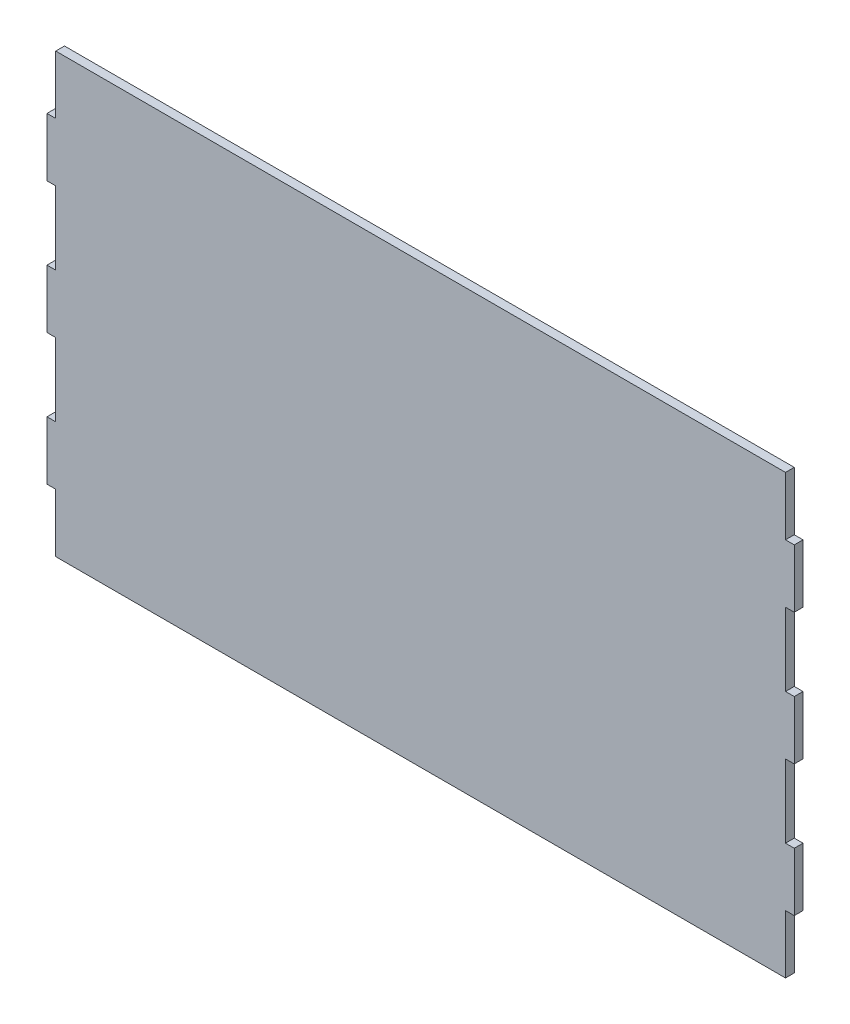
SolidWorks part; units mm, degrees
ref_plane "Alzado" through (0, 0, 0) normal (0, 0, 1) x (1, 0, 0)
ref_plane "Planta" through (0, 0, 0) normal (0, 1, 0) x (1, 0, 0)
ref_plane "Vista lateral" through (0, 0, 0) normal (1, 0, 0) x (0, 0, -1)
sketch "Croquis1" plane through (0, 0, 0) normal (0, 0, 1) x (1, 0, 0)
  line L0 (-500, 140) -> (-512, 140)
  line L1 (500, -380) -> (-500, -380)
  line L2 (500, -380) -> (500, -300)
  line L3 (500, 220) -> (-500, 220)
  line L4 (-500, -380) -> (-500, -300)
  line L5 (0, 220) -> (0, -380) construction
  line L7 (-512, 140) -> (-512, 60)
  line L8 (-512, 60) -> (-500, 60)
  line L9 (-500, -40) -> (-512, -40)
  line L10 (-512, -40) -> (-512, -120)
  line L11 (-512, -120) -> (-500, -120)
  line L12 (-500, -220) -> (-512, -220)
  line L13 (-512, -220) -> (-512, -300)
  line L14 (-512, -300) -> (-500, -300)
  line L15 (-500, 140) -> (-500, 220)
  line L16 (-500, -40) -> (-500, 60)
  line L17 (-500, -220) -> (-500, -120)
  line L18 (500, 140) -> (512, 140)
  line L19 (512, 140) -> (512, 60)
  line L20 (512, 60) -> (500, 60)
  line L21 (500, -40) -> (512, -40)
  line L22 (512, -40) -> (512, -120)
  line L23 (512, -120) -> (500, -120)
  line L24 (500, -220) -> (512, -220)
  line L25 (512, -220) -> (512, -300)
  line L26 (512, -300) -> (500, -300)
  line L27 (500, 140) -> (500, 220)
  line L28 (500, -40) -> (500, 60)
  line L29 (500, -220) -> (500, -120)
  point P0 (0, 0)
extrude "Saliente-Extruir1" add sketch "Croquis1" along normal blind 12
equation "\"Material\"= 12"
equation "\"D3@Croquis1\"=\"Material\""
equation "\"D4@Croquis1\"=\"Material\""
equation "\"D5@Croquis1\"=\"Material\""
equation "\"DsPared\" = 80"
equation "\"D6@Croquis1\"=\"DsPared\""
equation "\"D7@Croquis1\"=\"DsPared\""
equation "\"Pestaña\"=80"
equation "\"D8@Croquis1\"=\"Pestaña\""
equation "\"D9@Croquis1\"=\"Pestaña\""
equation "\"D10@Croquis1\"=\"Pestaña\""
equation "\"D11@Croquis1\"=\"Material\""
equation "\"D12@Croquis1\"=\"Pestaña\""
equation "\"D13@Croquis1\"=\"Material\""
equation "\"D14@Croquis1\"=\"Pestaña\""
equation "\"D15@Croquis1\"=\"Material\""
equation "\"D16@Croquis1\"=\"Pestaña\""
equation "\"LargoMesa\"= 600"
equation "\"D1@Croquis1\"=\"LargoMesa\""
